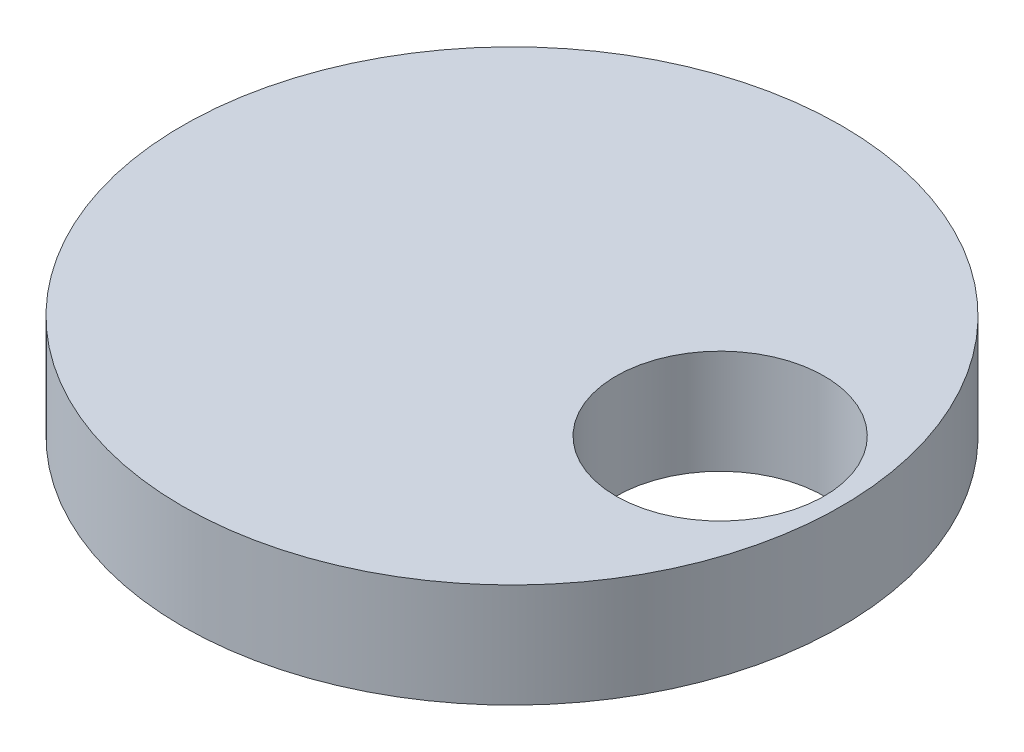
SolidWorks part; units mm, degrees
ref_plane "Front" through (0, 0, 0) normal (0, 0, 1) x (1, 0, 0)
ref_plane "Top" through (0, 0, 0) normal (0, 1, 0) x (1, 0, 0)
ref_plane "Right" through (0, 0, 0) normal (1, 0, 0) x (0, 0, -1)
sketch "Sketch1" plane through (0, 0, 0) normal (0, 1, 0) x (1, 0, 0)
  circle A0 centre (0, 0) radius 9.5
  circle A1 centre (6, 0) radius 3
extrude "Extrude1" add sketch "Sketch1" along normal blind 3
